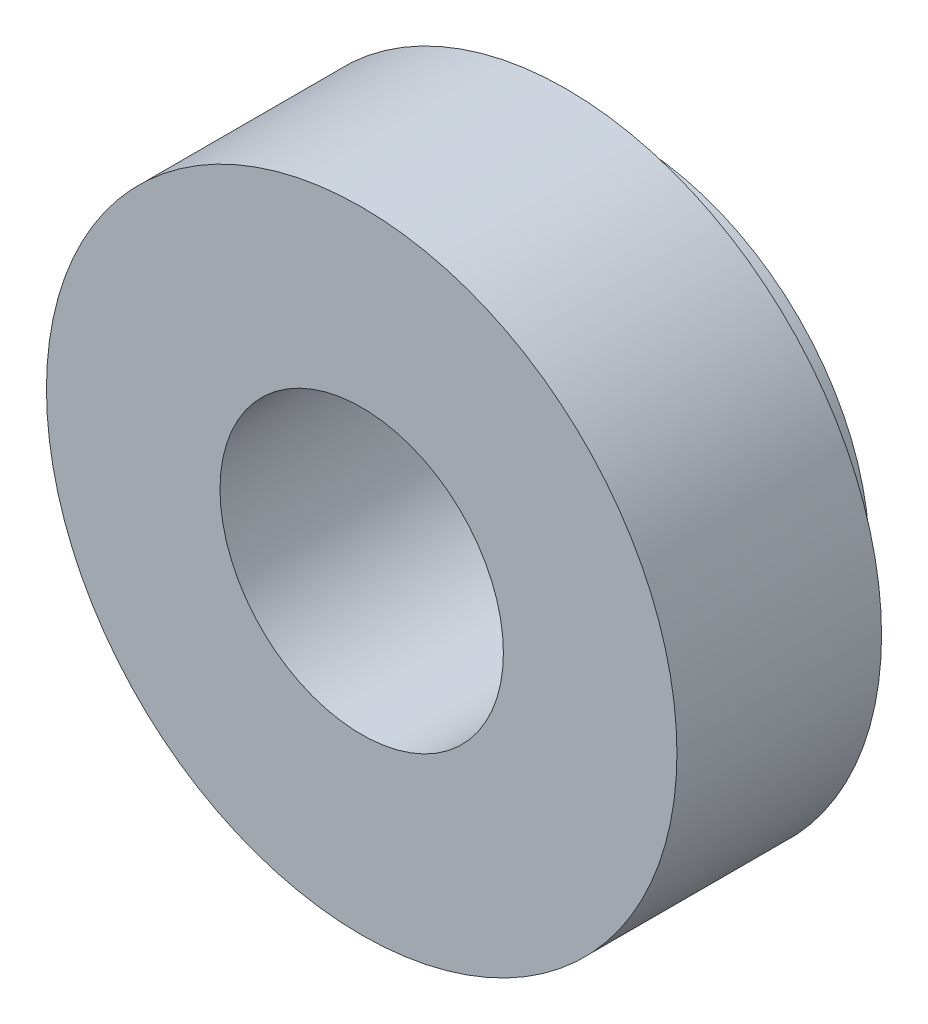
SolidWorks part; units mm, degrees
ref_plane "Front Plane" through (0, 0, 0) normal (0, 0, 1) x (1, 0, 0)
ref_plane "Top Plane" through (0, 0, 0) normal (0, 1, 0) x (1, 0, 0)
ref_plane "Right Plane" through (0, 0, 0) normal (1, 0, 0) x (0, 0, -1)
sketch "Sketch1" plane through (0, 0, 0) normal (0, 0, 1) x (1, 0, 0)
  circle A0 centre (0, 0) radius 15.8496
  dimension "D1" = 31.6992
extrude "Extrude1" add sketch "Sketch1" along normal blind 13.462
sketch "Sketch2" plane through (0, 0, 0) normal (0, 0, 1) x (1, 0, 0)
  circle A0 centre (0, 0) radius 12.065
  dimension "D1" = 24.13
extrude "Cut-Extrude1" cut sketch "Sketch2" along normal blind 3.175 flip side to cut
sketch "Sketch3" plane through (0, 0, 0) normal (0, 0, -1) x (-1, 0, 0)
  circle A0 centre (0, 0) radius 7.1247
  dimension "D1" = 14.2494
extrude "Cut-Extrude2" cut sketch "Sketch3" against normal through all
